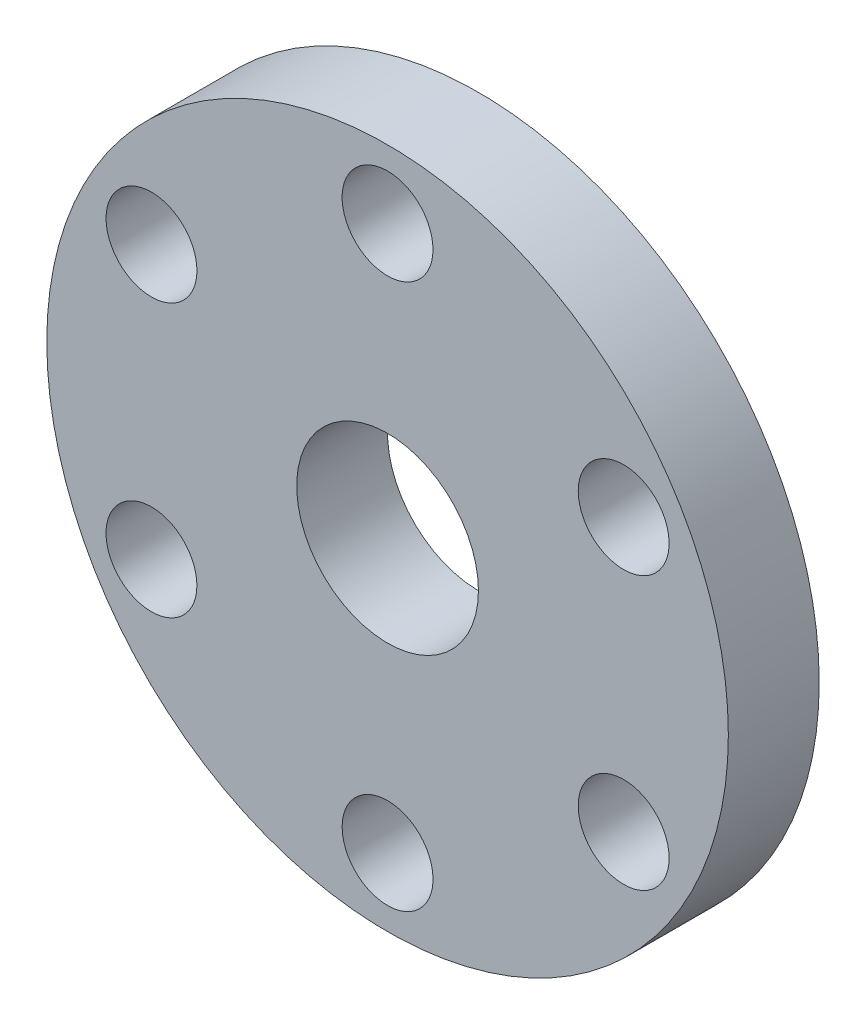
SolidWorks part; units mm, degrees
ref_plane "Płaszczyzna przednia" through (0, 0, 0) normal (0, 0, 1) x (1, 0, 0)
ref_plane "Płaszczyzna górna" through (0, 0, 0) normal (0, 1, 0) x (1, 0, 0)
ref_plane "Płaszczyzna prawa" through (0, 0, 0) normal (1, 0, 0) x (0, 0, -1)
sketch "Szkic1" plane through (0, 0, 0) normal (0, 0, 1) x (1, 0, 0)
  circle A0 centre (0, 0) radius 20
  circle A1 centre (0, 0) radius 75
  dimension "D1" = 40
  dimension "D2" = 150
extrude "Dodanie-wyciągnięcie1" add sketch "Szkic1" along normal blind 20
sketch "Szkic2" plane through (0, 0, 20) normal (0, 0, 1) x (1, 0, 0)
  circle A0 centre (0, 0) radius 60 construction
  circle A1 centre (0, 60) radius 10
  dimension "D1" = 120
  dimension "D2" = 20
extrude "Wytnij-wyciągnięcie1" cut sketch "Szkic2" against normal through all
pattern_circular "Szyk kołowy1" count 6 over 360 about axis through (0, 0, 0) along (0, 0, 1) of "Wytnij-wyciągnięcie1"
